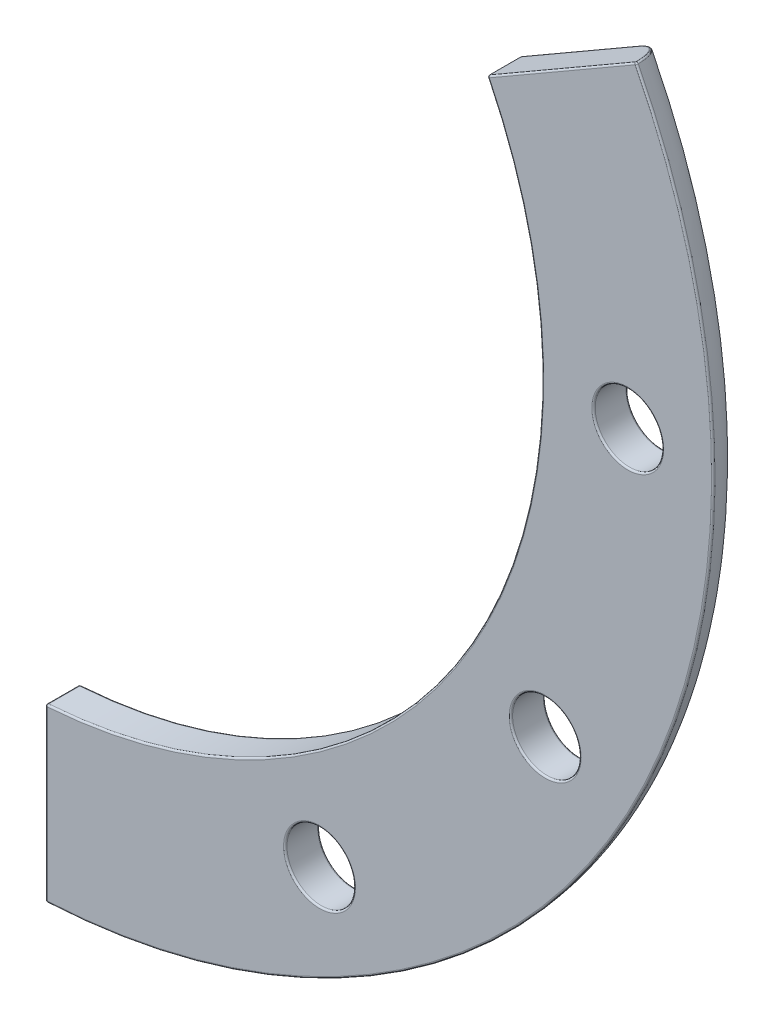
SolidWorks part; units mm, degrees
ref_plane "Спереди" through (0, 0, 0) normal (0, 0, 1) x (1, 0, 0)
ref_plane "Сверху" through (0, 0, 0) normal (0, 1, 0) x (1, 0, 0)
ref_plane "Справа" through (0, 0, 0) normal (1, 0, 0) x (0, 0, -1)
sketch "Эскиз1" plane through (0, 0, 0) normal (0, 0, 1) x (1, 0, 0)
  line L0 (0, 0) -> (0, -205) construction
  line L1 (0, 0) -> (177.5352, 102.5) construction
  line L2 (138.9543, 68.6783) -> (182.3239, 93.7177)
  line L3 (0, 0) -> (205, 0) construction
  line L4 (10, -204.756) -> (10, -154.6771)
  line L5 (155.8846, -90) -> (0, 0) construction
  line L6 (0, 0) -> (90, -155.8846) construction
  arc A0 (10, -204.756) -> (182.3239, 93.7177) centre (0, 0) ccw
  arc A1 (10, -179.722) -> (160.6438, 81.2007) centre (0, 0) ccw construction
  arc A2 (10, -154.6771) -> (138.9543, 68.6783) centre (0, 0) ccw
  circle A3 centre (0, 0) radius 155 construction
  circle A4 centre (0, 0) radius 205 construction
  circle A5 centre (0, 0) radius 180 construction
  circle A6 centre (180, 0) radius 10
  circle A7 centre (155.8846, -90) radius 10
  circle A8 centre (90, -155.8846) radius 10
  dimension "D1" = 410
  dimension "D3" = 50
  dimension "D7" = 20
  dimension "D4" = 120
  dimension "D5" = 10
  dimension "D6" = 10
  dimension "D8" = 30
  dimension "D9" = 30
  dimension "D2" = 25
extrude "Бобышка-Вытянуть1" add sketch "Эскиз1" along normal mid plane 10
fillet "Скругление1" radius 10 1 edges at (177.5352, -102.5, -5)
fillet "Скругление2" radius 0.5 17 edges at (10, -179.7165, 5) (10, -201.0043, -2.8039) (10, -174.7103, -5) (156.3035, 78.6949, -5) (180.4278, 92.623, -1.2413) (160.6391, 81.198, 5) (138.9543, 68.6783, 0) (134.2339, -77.5, 5) (10, -154.6771, 0) (134.2339, -77.5, -5) (100, -155.8846, -5) (100, -155.8846, 5) (165.8846, -90, -5) (165.8846, -90, 5) (190, 0, -5) (190, 0, 5) (177.5352, -102.5, 5)
